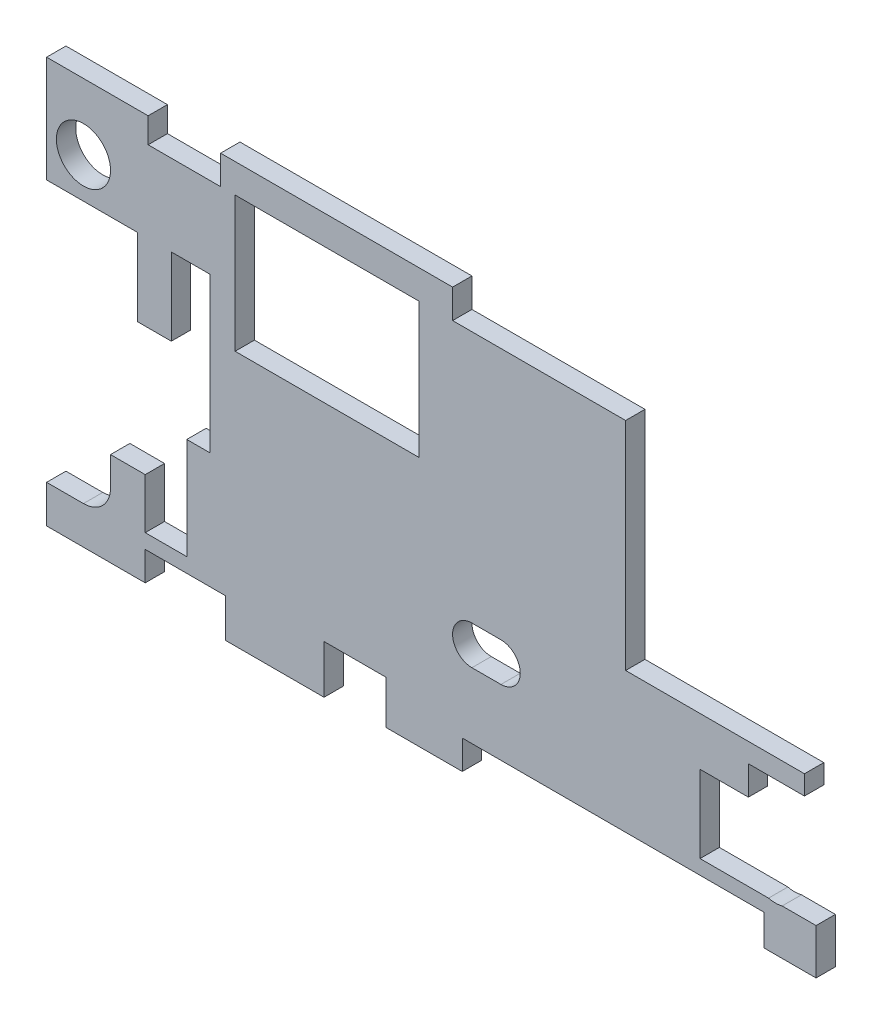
SolidWorks part; units mm, degrees
ref_plane "前视基准面" through (0, 0, 0) normal (0, 0, 1) x (1, 0, 0)
ref_plane "上视基准面" through (0, 0, 0) normal (0, 1, 0) x (1, 0, 0)
ref_plane "右视基准面" through (0, 0, 0) normal (1, 0, 0) x (0, 0, -1)
sketch "草图1" plane through (0, 0, 0) normal (0, 0, 1) x (1, 0, 0)
  line L1 (-42.55, 27.5) -> (42.55, 27.5)
  line L2 (-42.55, 27.5) -> (-42.55, -27.5)
  line L3 (-42.55, -27.5) -> (42.55, -27.5)
  line L4 (42.55, 27.5) -> (42.55, -27.5)
  line L5 (-42.55, 27.5) -> (42.55, -27.5) construction
  line L6 (-42.55, -27.5) -> (42.55, 27.5) construction
  circle A0 centre (-38.74, 14.16) radius 2.8
  circle A2 centre (32.84, -14.29) radius 2.8
  circle A3 centre (-38.74, -14.29) radius 2.8
  circle A4 centre (32.84, 14.16) radius 2.8
  point P0 (0, 0)
  dimension "D3" = 5.6
  dimension "D4" = 3.81
  dimension "D5" = 13.34
  dimension "D8" = 3.81
  dimension "D9" = 13.21
  dimension "D10" = 9.71
  dimension "D11" = 13.21
  dimension "D1" = 85.1
  dimension "D2" = 55
  dimension "D6" = 2
  dimension "D7" = 2
extrude "凸台-拉伸1" add sketch "草图1" along normal blind 2
sketch "草图2" plane through (0, 0, 2) normal (0, 0, 1) x (1, 0, 0)
  line L0 (-42.55, 21) -> (-32.05, 21)
  line L1 (42.55, 27.5) -> (-42.55, 27.5) construction
  line L2 (-42.55, 27.5) -> (-42.55, -27.5)
  line L3 (-42.55, -27.5) -> (42.55, -27.5)
  line L4 (42.55, 27.5) -> (42.55, -27.5)
  line L5 (-32.05, 21) -> (-32.05, 18.4)
  line L6 (-32.05, 18.4) -> (-24.55, 18.4)
  line L7 (-0.55, 18.4) -> (17.35, 18.4)
  line L8 (37.05, -17) -> (37.05, -21.7)
  line L9 (-33.15, 10) -> (-42.55, 10)
  line L10 (30.05, -4) -> (35.85, -4)
  line L11 (17.35, 18.4) -> (17.35, -4)
  line L12 (17.35, -4) -> (30.05, -4)
  line L13 (30.05, -6) -> (30.05, -9)
  line L14 (30.05, -9) -> (25.05, -9)
  line L15 (25.05, -9) -> (25.05, -17)
  line L16 (25.05, -17) -> (30.65, -17)
  line L17 (37.05, -21.7) -> (31.05, -21.7)
  line L18 (31.05, -18.5) -> (31.05, -21.7)
  line L19 (-38.74, -17.09) -> (-42.55, -17.09)
  line L21 (-24.55, 21.4) -> (-0.55, 21.4)
  line L22 (31.05, -18.5) -> (0.45, -18.5)
  line L23 (0.45, -18.5) -> (0.45, -21.5)
  line L24 (0.45, -21.5) -> (-7.45, -21.5)
  line L25 (-7.45, -21.5) -> (-7.45, -17)
  line L26 (-7.45, -17) -> (-13.85, -17)
  line L27 (-13.85, -17) -> (-13.85, -22)
  line L28 (-13.85, -22) -> (-24.05, -22)
  line L29 (-24.05, -22) -> (-24.05, -18)
  line L30 (-24.05, -18) -> (-32.35, -18)
  line L31 (-32.35, -18) -> (-32.35, -21)
  line L32 (-32.35, -21) -> (-42.55, -21)
  line L34 (-32.35, -11.3) -> (-32.35, -16.5)
  line L35 (-32.35, -16.5) -> (-28.05, -16.5)
  line L36 (-28.05, -16.5) -> (-28.05, -6)
  line L37 (-28.05, -6) -> (-25.65, -6)
  line L38 (-25.65, -6) -> (-25.65, 10)
  line L39 (-25.65, 10) -> (-29.65, 10)
  line L40 (30.05, -6) -> (35.85, -6)
  line L41 (35.85, -4) -> (35.85, -6)
  line L42 (-23.05, 18.4) -> (-23.05, 4.4)
  line L43 (-23.05, 4.4) -> (-4.05, 4.4)
  line L44 (-4.05, 18.4) -> (-4.05, 4.4)
  line L45 (-24.55, 21.4) -> (-24.55, 18.4)
  line L46 (-23.05, 18.4) -> (-4.05, 18.4)
  line L47 (-0.55, 21.4) -> (-0.55, 18.4)
  line L48 (30.65, -17) -> (37.05, -17)
  line L49 (-33.15, 10) -> (-33.15, 2)
  line L50 (-33.15, 2) -> (-29.65, 2)
  line L51 (-29.65, 10) -> (-29.65, 2)
  line L54 (-35.94, -14.29) -> (-35.94, -11.3)
  line L56 (-35.94, -11.3) -> (-32.35, -11.3)
  circle A0 centre (-38.74, -14.29) radius 2.8 construction
  arc A1 (-38.74, -17.09) -> (-35.94, -14.29) centre (-38.74, -14.29) ccw
  point P20 (-24.05, -20)
  point P54 (-24.55, 19.9)
  dimension "D18" = 5.6
  dimension "D2" = 10.5
  dimension "D4" = 9.1
  dimension "D5" = 19.5
  dimension "D6" = 6.5
  dimension "D7" = 17.5
  dimension "D8" = 23.1
  dimension "D9" = 38.5
  dimension "D10" = 31.5
  dimension "D11" = 25.2
  dimension "D12" = 12
  dimension "D13" = 12.5
  dimension "D14" = 18.5
  dimension "D15" = 17.5
  dimension "D16" = 3.2
  dimension "D17" = 3.91
  dimension "D19" = 9
  dimension "D20" = 10.5
  dimension "D21" = 42.1
  dimension "D22" = 6
  dimension "D23" = 10.5
  dimension "D24" = 50
  dimension "D25" = 5.5
  dimension "D26" = 56.4
  dimension "D27" = 18.5
  dimension "D28" = 6.5
  dimension "D29" = 10.2
  dimension "D30" = 9.5
  dimension "D31" = 11
  dimension "D32" = 14.5
  dimension "D33" = 16.9
  dimension "D34" = 21.5
  dimension "D35" = 16.2
  dimension "D36" = 6
  dimension "D37" = 5.8
  dimension "D38" = 2
  dimension "D39" = 5.8
  dimension "D40" = 3
  dimension "D41" = 1.5
  dimension "D42" = 24
  dimension "D43" = 3.5
  dimension "D44" = 8
  dimension "D45" = 9.4
  dimension "D46" = 6.61
extrude "切除-拉伸2" cut sketch "草图2" against normal through all
sketch "草图3" plane through (0, 0, 5.5) normal (0, 0, 1) x (1, 0, 0)
  line L0 (1.45, -9.7) -> (4.45, -9.7) construction
  line L1 (1.45, -7.7) -> (4.45, -7.7)
  line L2 (1.45, -11.7) -> (4.45, -11.7)
  arc A0 (1.45, -7.7) -> (1.45, -11.7) centre (1.45, -9.7) ccw
  arc A1 (4.45, -11.7) -> (4.45, -7.7) centre (4.45, -9.7) ccw
  point P4 (2.95, -9.7)
  dimension "D1" = 2
extrude "切除-拉伸3" cut sketch "草图3" against normal through all both and the other way through all
sketch "草图4" plane through (0, 0, 2) normal (0, 0, 1) x (1, 0, 0)
  line L1 (31.05, -21.7) -> (31.65, -21.7)
  line L2 (31.05, -21.7) -> (31.05, -18.5)
  line L3 (31.05, -18.5) -> (31.65, -18.5)
  line L4 (31.65, -21.7) -> (31.65, -18.5)
extrude "切除-拉伸4" cut sketch "草图4" against normal through all
